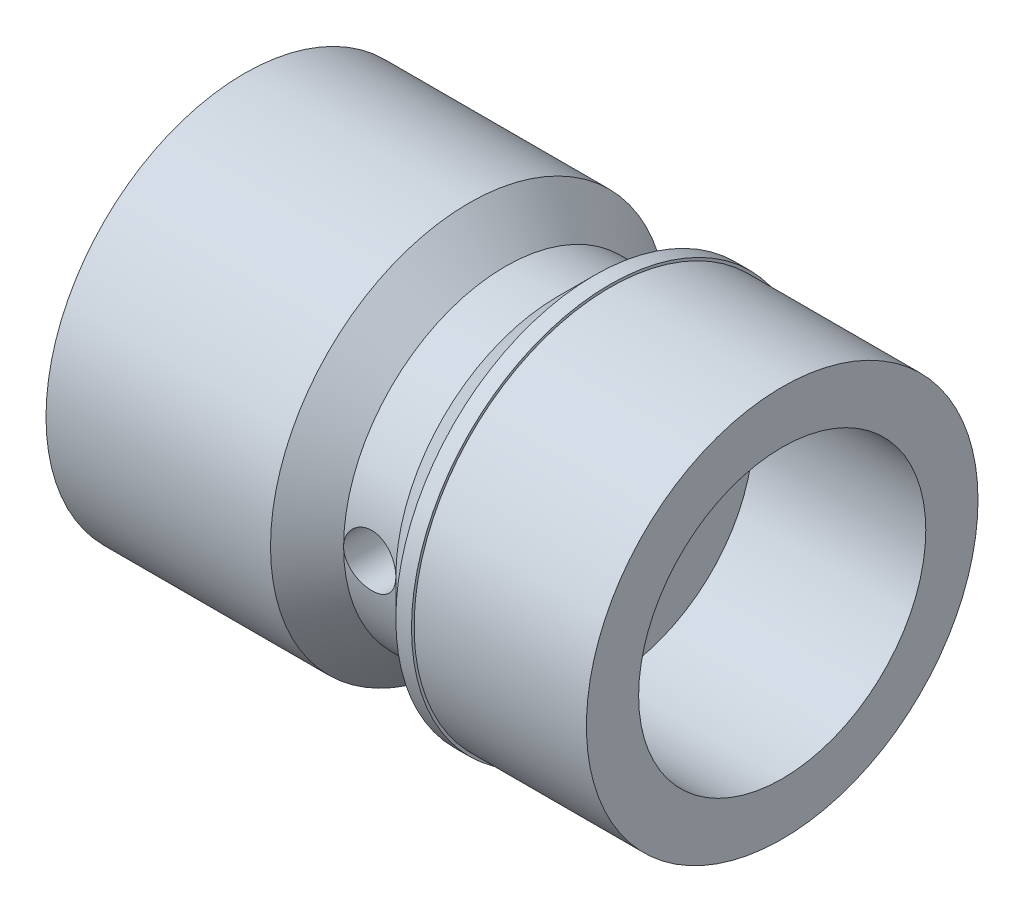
SolidWorks part; units mm, degrees
ref_plane "Front Plane" through (0, 0, 0) normal (0, 0, 1) x (1, 0, 0)
ref_plane "Top Plane" through (0, 0, 0) normal (0, 1, 0) x (1, 0, 0)
ref_plane "Right Plane" through (0, 0, 0) normal (1, 0, 0) x (0, 0, -1)
sketch "Sketch1" plane through (0, 0, 0) normal (0, 0, 1) x (1, 0, 0)
  line L0 (0, 0) -> (0, 7.1447) construction
  line L1 (1.905, 0) -> (-1.905, 0)
  line L2 (-1.905, 0) -> (-1.905, 4.826)
  line L3 (-1.905, 4.826) -> (-1.524, 4.826)
  line L4 (-1.524, 4.826) -> (-0.635, 3.937)
  line L5 (-0.635, 3.937) -> (0.635, 3.937)
  line L7 (1.905, 0) -> (1.905, 4.826)
  line L8 (1.905, 4.826) -> (1.524, 4.826)
  line L9 (1.524, 4.826) -> (0.635, 3.937)
  point P10 (0, 0)
  point P13 (0, 3.937)
  dimension "D1" = 4.826
  dimension "D2" = 0.381
  dimension "D3" = 0.635
  dimension "D4" = 1.905
  dimension "D5" = 135
revolve "Revolve1" add sketch "Sketch1" angle 360 about L1
ref_plane "Plane1" through (0, 0, 3.937) normal (0, 0, 1) x (1, 0, 0)
sketch "Sketch2" plane through (0, 0, 3.937) normal (0, 0, 1) x (1, 0, 0)
  circle A0 centre (0, 0) radius 0.635
  dimension "D1" = 1.27
extrude "Cut-Extrude1" cut sketch "Sketch2" against normal through all
sketch "Sketch3" plane through (1.905, 0, 0) normal (1, 0, 0) x (0, 0, -1)
  circle A0 centre (0, 0) radius 3.4925
  circle A1 centre (0, 0) radius 4.7625
  dimension "D1" = 6.985
  dimension "D2" = 9.525
extrude "Boss-Extrude1" add sketch "Sketch3" along normal blind 4.191
sketch "Sketch5" plane through (-1.905, 0, 0) normal (-1, 0, 0) x (0, 0, 1)
  circle A0 centre (0, 0) radius 4.826 construction
  circle A1 centre (0, 0) radius 4.826
extrude "Boss-Extrude2" add sketch "Sketch5" along normal blind 5.08
sketch "Sketch6" plane through (-6.985, 0, 0) normal (-1, 0, 0) x (0, 0, 1)
  line L1 (1.4434, 0) -> (0.7217, 1.25)
  line L2 (0.7217, 1.25) -> (-0.7217, 1.25)
  line L3 (-0.7217, 1.25) -> (-1.4434, 0)
  line L4 (-1.4434, 0) -> (-0.7217, -1.25)
  line L5 (-0.7217, -1.25) -> (0.7217, -1.25)
  line L6 (0.7217, -1.25) -> (1.4434, 0)
  circle A0 centre (0, 0) radius 1.25 construction
  dimension "D1" = 2.5
extrude "Cut-Extrude3" cut sketch "Sketch6" against normal blind 5.08
